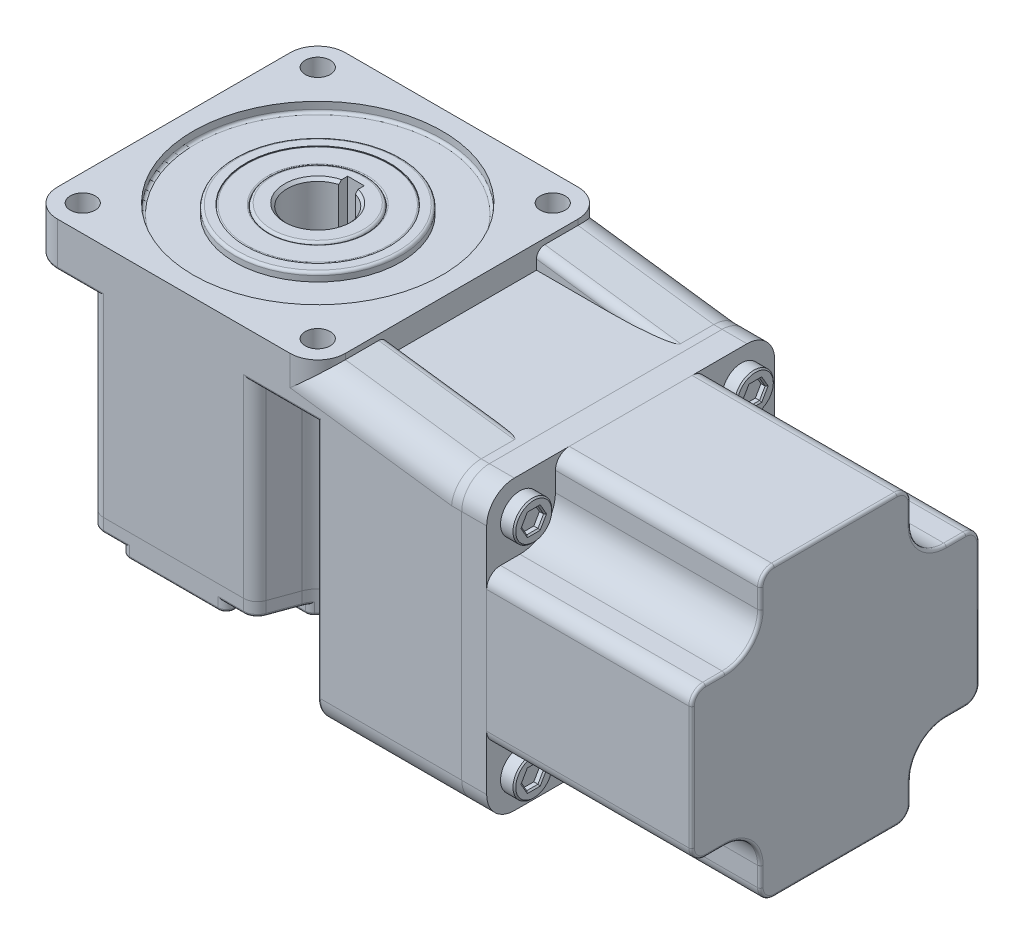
SolidWorks part; units mm, degrees
ref_plane "前视基准面" through (0, 0, 0) normal (0, 0, 1) x (1, 0, 0)
ref_plane "上视基准面" through (0, 0, 0) normal (0, 1, 0) x (1, 0, 0)
ref_plane "右视基准面" through (0, 0, 0) normal (1, 0, 0) x (0, 0, -1)
imported_body "100中空改进箱体-1-surface1"
imported_body "中空出轴-1-surface1"
imported_body "100中空改进箱盖-1-surface1"
imported_body "出轴中空油封-1-surface1"
imported_body "出轴中空油封-2-surface1"
imported_body "100中空风叶-1-surface1"
sketch "草图2" plane through (94.9743, 0, 0) normal (1, 0, 0) x (0, 0, -1)
  line L0 (-27.1716, -54.1458) -> (-27.1716, -61.1458)
  line L7 (-42, -66.1458) -> (42, -66.1458) construction
  line L9 (27.1716, -54.1458) -> (27.1716, -61.1458)
  line L10 (22.1716, -66.1458) -> (-22.1716, -66.1458)
  line L11 (-40, -41.3174) -> (-47, -41.3174)
  line L12 (-52, 27.8542) -> (-52, -56.1458) construction
  line L13 (-52, -36.3174) -> (-52, 8.0258)
  line L14 (-47, 13.0258) -> (-40, 13.0258)
  line L16 (-27.1716, 25.8542) -> (-27.1716, 32.8542)
  line L17 (42, 37.8542) -> (-42, 37.8542) construction
  line L18 (-22.1716, 37.8542) -> (22.1716, 37.8542)
  line L19 (27.1716, 32.8542) -> (27.1716, 25.8542)
  line L21 (40, 13.0258) -> (47, 13.0258)
  line L22 (52, -56.1458) -> (52, 27.8542) construction
  line L23 (52, 8.0258) -> (52, -36.3174)
  line L24 (47, -41.3174) -> (40, -41.3174)
  arc A0 (-40, 13.0258) -> (-27.1716, 25.8542) centre (-40, 25.8542) ccw
  arc A1 (27.1716, 25.8542) -> (40, 13.0258) centre (40, 25.8542) ccw
  arc A2 (40, -41.3174) -> (27.1716, -54.1458) centre (40, -54.1458) ccw
  arc A3 (-27.1716, -54.1458) -> (-40, -41.3174) centre (-40, -54.1458) ccw
  arc A4 (-27.1716, 32.8542) -> (-22.1716, 37.8542) centre (-22.1716, 32.8542) cw
  arc A5 (22.1716, 37.8542) -> (27.1716, 32.8542) centre (22.1716, 32.8542) cw
  arc A6 (47, 13.0258) -> (52, 8.0258) centre (47, 8.0258) cw
  arc A7 (52, -36.3174) -> (47, -41.3174) centre (47, -36.3174) cw
  arc A8 (27.1716, -61.1458) -> (22.1716, -66.1458) centre (22.1716, -61.1458) cw
  arc A9 (-27.1716, -61.1458) -> (-22.1716, -66.1458) centre (-22.1716, -61.1458) ccw
  arc A10 (-47, -41.3174) -> (-52, -36.3174) centre (-47, -36.3174) cw
  arc A11 (-52, 8.0258) -> (-47, 13.0258) centre (-47, 8.0258) cw
  point P0 (0, -14.1458)
  point P7 (-27.1716, 37.8542)
  point P34 (27.1716, 37.8542)
  point P37 (52, 13.0258)
  point P40 (52, -41.3174)
  point P43 (27.1716, -66.1458)
  point P46 (-27.1716, -66.1458)
  point P49 (-52, -41.3174)
  point P52 (-52, 13.0258)
  dimension "D1" = 5
extrude "凸台-拉伸1" add sketch "草图2" along normal blind 74
fillet "圆角1" radius 1 24 edges at (168.9743, 37.8542, 0) (168.9743, 36.3897, -25.7071) (168.9743, 29.3542, -27.1716) (168.9743, 16.7831, -30.9289) (168.9743, 13.0258, -43.5) (168.9743, 11.5613, -50.5355) (168.9743, -14.1458, -52) (168.9743, -39.8529, -50.5355) (168.9743, -41.3174, -43.5) (168.9743, -45.0747, -30.9289) (168.9743, -57.6458, -27.1716) (168.9743, -64.6813, -25.7071) (168.9743, -66.1458, 0) (168.9743, -64.6813, 25.7071) (168.9743, -57.6458, 27.1716) (168.9743, -45.0747, 30.9289) (168.9743, -41.3174, 43.5) (168.9743, -39.8529, 50.5355) (168.9743, -14.1458, 52) (168.9743, 11.5613, 50.5355) (168.9743, 13.0258, 43.5) (168.9743, 16.7831, 30.9289) (168.9743, 29.3542, 27.1716) (168.9743, 36.3897, 25.7071)
sketch "草图3" plane through (94.9743, 0, 0) normal (1, 0, 0) x (0, 0, -1)
  circle A0 centre (-40, 25.8542) radius 7
  circle A1 centre (40, 25.8542) radius 7
  circle A2 centre (-40, -54.1458) radius 7
  circle A3 centre (40, -54.1458) radius 7
extrude "凸台-拉伸2" add sketch "草图3" along normal blind 5 separate body
sketch "草图4" plane through (99.9743, 0, 0) normal (1, 0, 0) x (0, 0, -1)
  line L1 (-35.9585, 25.8542) -> (-37.9793, 29.3542)
  line L2 (-37.9793, 29.3542) -> (-42.0207, 29.3542)
  line L3 (-42.0207, 29.3542) -> (-44.0415, 25.8542)
  line L4 (-44.0415, 25.8542) -> (-42.0207, 22.3542)
  line L5 (-42.0207, 22.3542) -> (-37.9793, 22.3542)
  line L6 (-37.9793, 22.3542) -> (-35.9585, 25.8542)
  line L7 (44.0415, 25.8542) -> (42.0207, 29.3542)
  line L8 (42.0207, 29.3542) -> (37.9793, 29.3542)
  line L9 (37.9793, 29.3542) -> (35.9585, 25.8542)
  line L10 (35.9585, 25.8542) -> (37.9793, 22.3542)
  line L11 (37.9793, 22.3542) -> (42.0207, 22.3542)
  line L12 (42.0207, 22.3542) -> (44.0415, 25.8542)
  line L13 (44.0415, -54.1458) -> (42.0207, -50.6458)
  line L14 (42.0207, -50.6458) -> (37.9793, -50.6458)
  line L15 (37.9793, -50.6458) -> (35.9585, -54.1458)
  line L16 (35.9585, -54.1458) -> (37.9793, -57.6458)
  line L17 (37.9793, -57.6458) -> (42.0207, -57.6458)
  line L18 (42.0207, -57.6458) -> (44.0415, -54.1458)
  line L19 (-35.9585, -54.1458) -> (-37.9793, -50.6458)
  line L20 (-37.9793, -50.6458) -> (-42.0207, -50.6458)
  line L21 (-42.0207, -50.6458) -> (-44.0415, -54.1458)
  line L22 (-44.0415, -54.1458) -> (-42.0207, -57.6458)
  line L23 (-42.0207, -57.6458) -> (-37.9793, -57.6458)
  line L24 (-37.9793, -57.6458) -> (-35.9585, -54.1458)
  circle A0 centre (-40, 25.8542) radius 3.5 construction
  circle A1 centre (40, 25.8542) radius 3.5 construction
  circle A2 centre (40, -54.1458) radius 3.5 construction
  circle A3 centre (-40, -54.1458) radius 3.5 construction
extrude "切除-拉伸1" cut sketch "草图4" against normal blind 2
chamfer "倒角1" distance 0.5 angle 45 7 edges at (99.9743, 25.8542, 33) (99.9743, 27.6042, 36.9689) (99.9743, 29.3542, 40) (99.9743, 27.6042, 43.0311) (99.9743, 24.1042, 43.0311) (99.9743, 22.3542, 40) (99.9743, 24.1042, 36.9689)
chamfer "倒角2" distance 0.5 angle 45 7 edges at (99.9743, 25.8542, -47) (99.9743, 27.6042, -43.0311) (99.9743, 29.3542, -40) (99.9743, 27.6042, -36.9689) (99.9743, 24.1042, -36.9689) (99.9743, 22.3542, -40) (99.9743, 24.1042, -43.0311)
chamfer "倒角3" distance 0.5 angle 45 7 edges at (99.9743, -54.1458, -47) (99.9743, -52.3958, -43.0311) (99.9743, -50.6458, -40) (99.9743, -52.3958, -36.9689) (99.9743, -55.8958, -36.9689) (99.9743, -57.6458, -40) (99.9743, -55.8958, -43.0311)
chamfer "倒角4" distance 0.5 angle 45 7 edges at (99.9743, -54.1458, 33) (99.9743, -52.3958, 36.9689) (99.9743, -50.6458, 40) (99.9743, -52.3958, 43.0311) (99.9743, -55.8958, 43.0311) (99.9743, -57.6458, 40) (99.9743, -55.8958, 36.9689)
